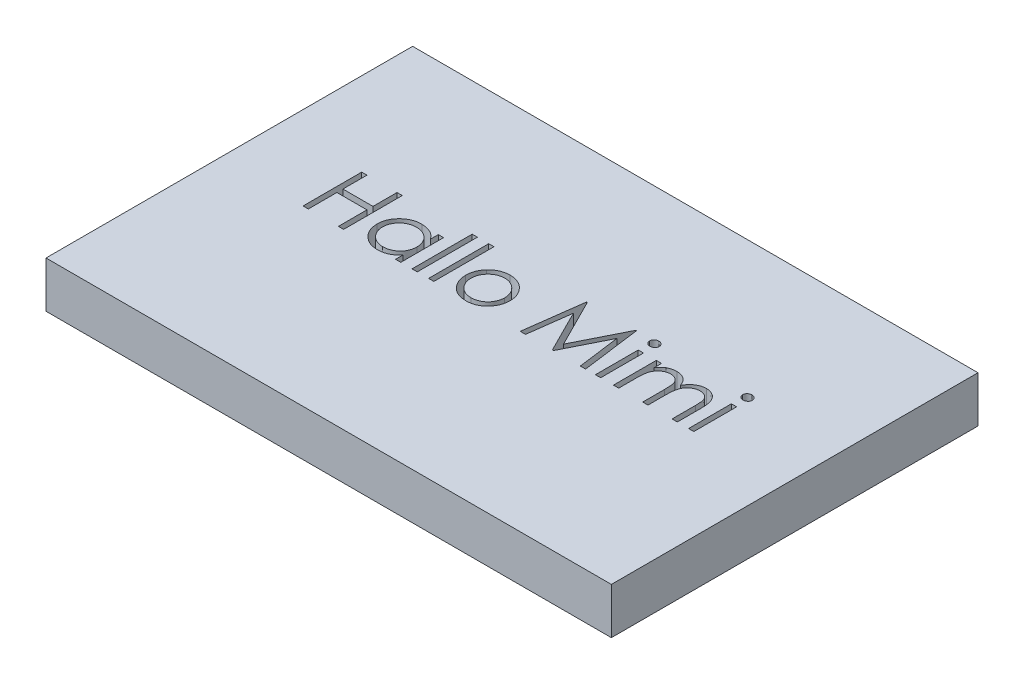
SolidWorks part; units mm, degrees
ref_plane "Ebene vorne" through (0, 0, 0) normal (0, 0, 1) x (1, 0, 0)
ref_plane "Ebene oben" through (0, 0, 0) normal (0, 1, 0) x (1, 0, 0)
ref_plane "Ebene rechts" through (0, 0, 0) normal (1, 0, 0) x (0, 0, -1)
sketch "Skizze1" plane through (0, 0, 0) normal (0, 1, 0) x (1, 0, 0)
  line L1 (0, 0) -> (122.5035, 0)
  line L2 (0, 0) -> (0, 79.4405)
  line L3 (0, 79.4405) -> (122.5035, 79.4405)
  line L4 (122.5035, 0) -> (122.5035, 79.4405)
extrude "Aufsatz-Linear austragen1" add sketch "Skizze1" along normal blind 10
sketch "Skizze2" plane through (0, 10, 0) normal (0, 1, 0) x (1, 0, 0)
  text T0 "Hallo Mimi" font "Century Gothic" height in points 48
extrude "Schnitt-Linear austragen1" cut sketch "Skizze2" against normal blind 10
